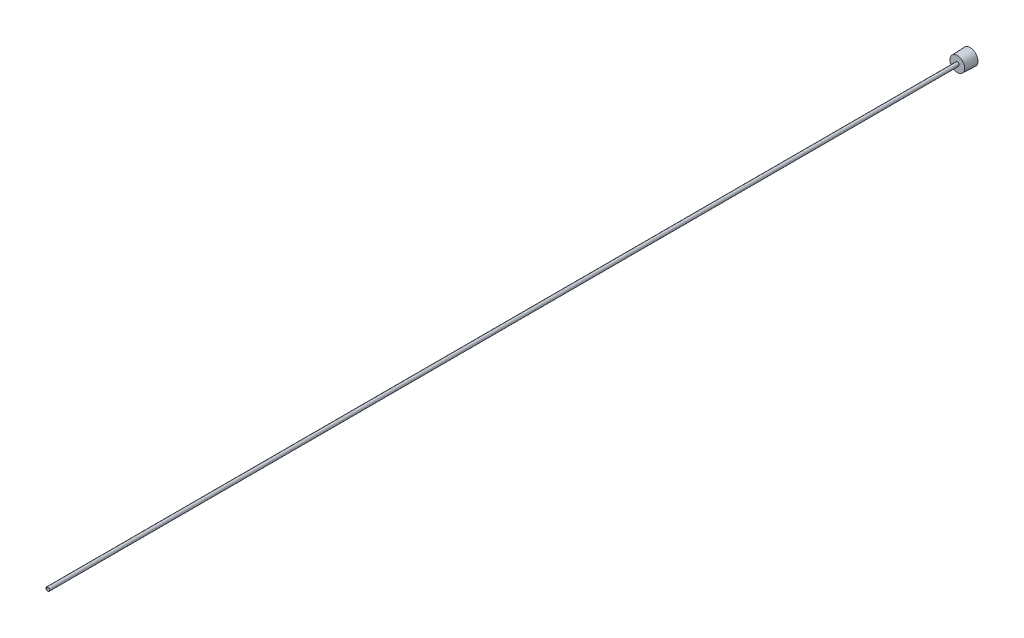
SolidWorks part; units mm, degrees
ref_plane "Front Plane" through (0, 0, 0) normal (0, 0, 1) x (1, 0, 0)
ref_plane "Top Plane" through (0, 0, 0) normal (0, 1, 0) x (1, 0, 0)
ref_plane "Right Plane" through (0, 0, 0) normal (1, 0, 0) x (0, 0, -1)
sketch "Sketch1" plane through (0, 0, 0) normal (1, 0, 0) x (0, 0, -1)
  line L0 (-457.2, 0) -> (0, 0)
  line L5 (0, 3.8989) -> (-6.35, 3.6674)
  line L6 (0, 0) -> (0, 3.8989)
  line L7 (-6.35, 3.6674) -> (-6.35, 0.9144)
  line L8 (-6.35, 0.9144) -> (-457.2, 0.9144)
  line L9 (-457.2, 0.9144) -> (-457.2, 0)
  line L10 (0, 0) -> (49989.3417, 0) construction
  dimension "D1" = 2.088
  dimension "D2" = 6.35
  dimension "D3" = 457.2
  dimension "D4" = 1.8288
  dimension "D5" = 7.7978
revolve "Revolve1" add sketch "Sketch1" angle 360 about L10
sketch "Sketch2" plane through (0, 0, 457.2) normal (0, 0, 1) x (1, 0, 0)
  circle A0 centre (0, 0) radius 0.762
  dimension "D1" = 1.524
extrude "Cut-Extrude1" cut sketch "Sketch2" against normal through all
sketch "Sketch3" plane through (0, 0, 0) normal (0, 0, -1) x (-1, 0, 0)
  line L0 (0, 4.2888) -> (0, -4.2888) construction
  line L1 (0, -2.7496) -> (2.3812, -1.3748)
  line L2 (2.3812, -1.3748) -> (2.3812, 1.3748)
  line L3 (2.3812, 1.3748) -> (0, 2.7496)
  line L4 (0, 2.7496) -> (-2.3813, 1.3748)
  line L5 (-2.3813, 1.3748) -> (-2.3813, -1.3748)
  line L6 (-2.3813, -1.3748) -> (0, -2.7496)
  circle A0 centre (0, 0) radius 2.3813 construction
  dimension "D1" = 4.7625
extrude "Cut-Extrude2" cut sketch "Sketch3" against normal blind 3.9688
